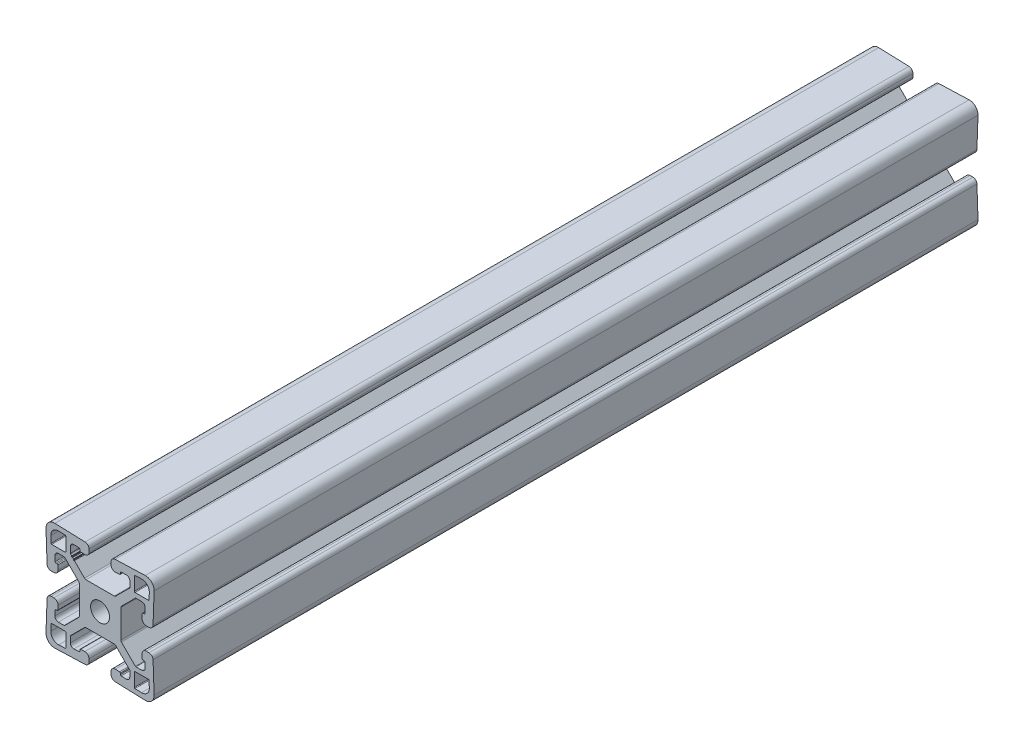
SolidWorks part; units mm, degrees
ref_plane "Front Plane" through (0, 0, 0) normal (0, 0, 1) x (1, 0, 0)
ref_plane "Top Plane" through (0, 0, 0) normal (0, 1, 0) x (1, 0, 0)
ref_plane "Right Plane" through (0, 0, 0) normal (1, 0, 0) x (0, 0, -1)
sketch "Sketch1" plane through (0, 0, 0) normal (0, 0, 1) x (1, 0, 0)
  line L0 (0, 0) -> (0, 20) construction
  line L1 (0, 0) -> (20, 0) construction
  line L2 (0, 0) -> (-20, 20) construction
  line L3 (-16.7142, 19.9981) -> (-5.5358, 19.6077)
  line L4 (-20, 20) -> (0, 20) construction
  line L5 (-4.064, 18.0836) -> (-4.064, 17.069)
  line L6 (-5.6422, 15.5449) -> (-7.1936, 15.5991)
  line L7 (-7.5, 15.9164) -> (-7.5, 16.3198)
  line L8 (-7.8064, 16.6371) -> (-9.6857, 16.7028)
  line L9 (-11, 15.4335) -> (-11, 13.2868)
  line L10 (0, 7.681) -> (-5.2101, 7.681)
  line L11 (-5.7489, 7.9042) -> (-10.907, 13.0623)
  line L12 (-7.9042, 5.7489) -> (-13.0623, 10.907)
  line L13 (-7.681, 0) -> (-7.681, 5.2101)
  line L14 (-15.4335, 11) -> (-13.2868, 11)
  line L15 (-16.6371, 7.8064) -> (-16.7028, 9.6857)
  line L16 (-15.9164, 7.5) -> (-16.3198, 7.5)
  line L17 (-15.5449, 5.6422) -> (-15.5991, 7.1936)
  line L18 (-18.0836, 4.064) -> (-17.069, 4.064)
  line L19 (-19.9981, 16.7142) -> (-19.6077, 5.5358)
  line L20 (-18.2207, 15.3309) -> (-18.1275, 12.661)
  line L21 (-15.3309, 18.2207) -> (-12.661, 18.1275)
  line L22 (-18.1275, 12.661) -> (-12.661, 12.661)
  line L23 (-12.661, 18.1275) -> (-12.661, 12.661)
  line L24 (0, 0) -> (-20, 0) construction
  line L25 (-20, 0) -> (0, 0) construction
  line L26 (0, 0) -> (0, -20) construction
  line L27 (-20, -20) -> (-20, 20) construction
  line L28 (0, 20) -> (20, 20) construction
  line L30 (-20, -20) -> (20, -20) construction
  arc A0 (-19.9981, 16.7142) -> (-16.7142, 19.9981) centre (-16.825, 16.825) cw
  arc A1 (-7.1936, 15.5991) -> (-7.5, 15.9164) centre (-7.1825, 15.9164) cw
  arc A2 (-7.5, 16.3198) -> (-7.8064, 16.6371) centre (-7.8175, 16.3198) ccw
  arc A3 (-9.6857, 16.7028) -> (-11, 15.4335) centre (-9.73, 15.4335) ccw
  arc A4 (-4.064, 17.069) -> (-5.6422, 15.5449) centre (-5.589, 17.069) cw
  arc A5 (-5.5358, 19.6077) -> (-4.064, 18.0836) centre (-5.589, 18.0836) cw
  arc A6 (-5.2101, 7.681) -> (-5.7489, 7.9042) centre (-5.2101, 8.443) cw
  arc A7 (-7.9042, 5.7489) -> (-7.681, 5.2101) centre (-8.443, 5.2101) cw
  arc A8 (-11, 13.2868) -> (-10.907, 13.0623) centre (-10.6825, 13.2868) ccw
  arc A9 (-18.0836, 4.064) -> (-19.6077, 5.5358) centre (-18.0836, 5.589) cw
  arc A10 (-15.5449, 5.6422) -> (-17.069, 4.064) centre (-17.069, 5.589) cw
  arc A11 (-15.9164, 7.5) -> (-15.5991, 7.1936) centre (-15.9164, 7.1825) cw
  arc A12 (-16.6371, 7.8064) -> (-16.3198, 7.5) centre (-16.3198, 7.8175) ccw
  arc A13 (-15.4335, 11) -> (-16.7028, 9.6857) centre (-15.4335, 9.73) ccw
  arc A14 (-13.0623, 10.907) -> (-13.2868, 11) centre (-13.2868, 10.6825) ccw
  arc A15 (-15.3309, 18.2207) -> (-18.2207, 15.3309) centre (-15.4284, 15.4284) ccw
  circle A16 centre (0, 0) radius 3.5
  point P26 (-7.5, 15.6098)
  point P29 (-7.5, 16.6264)
  point P32 (-11, 16.7487)
  point P35 (-4.064, 15.4898)
  point P38 (-4.064, 19.5563)
  point P42 (-5.5257, 7.681)
  point P45 (-7.681, 5.5257)
  point P48 (-11, 13.1553)
  point P51 (-19.5563, 4.064)
  point P54 (-15.4898, 4.064)
  point P57 (-15.6098, 7.5)
  point P60 (-16.6264, 7.5)
  point P63 (-16.7487, 11)
  point P66 (-13.1553, 11)
  point P80 (-20, 0)
  point P85 (0, -20)
  point P88 (0, -20)
sketch "Sketch2" plane through (0, 0, 0) normal (1, 0, 0) x (0, 0, -1)
  line L0 (-152.4, 0) -> (152.4, 0)
  line L1 (-152.4, -20) -> (-152.4, 20) construction
  line L2 (0, 0) -> (0, 20) construction
  line L3 (0, 0) -> (0, 20) construction
  line L4 (152.4, -20) -> (152.4, 20) construction
  point P0 (-92.4, 0)
  point P3 (0, 0)
  point P7 (92.4, 0)
  point P11 (-152.4, 0)
  point P14 (152.4, 0)
sketch "Sketch3" plane through (0, 0, 0) normal (0, 0, 1) x (1, 0, 0)
  line L0 (-7.681, 0) -> (-7.681, 5.2101) construction
  line L1 (-7.9042, 5.7489) -> (-13.0623, 10.907) construction
  line L2 (-15.4335, 11) -> (-13.2868, 11) construction
  line L3 (-16.6371, 7.8064) -> (-16.7028, 9.6857) construction
  line L4 (-18.2207, 15.3309) -> (-18.1275, 12.661)
  line L5 (-18.1275, 12.661) -> (-12.661, 12.661)
  line L6 (-12.661, 12.661) -> (-12.661, 18.1275)
  line L7 (-12.661, 18.1275) -> (-15.3309, 18.2207)
  line L8 (-18.2207, 15.3309) -> (-18.136, 12.9061)
  line L9 (-17.8822, 12.661) -> (-12.915, 12.661)
  line L10 (-12.661, 12.915) -> (-12.661, 17.8822)
  line L11 (-12.9061, 18.136) -> (-15.3309, 18.2207)
  line L12 (-15.9164, 7.5) -> (-16.3198, 7.5) construction
  line L13 (-15.5449, 5.6422) -> (-15.5991, 7.1936) construction
  line L14 (-18.0836, 4.064) -> (-17.069, 4.064) construction
  line L15 (-19.9981, 16.7142) -> (-19.6077, 5.5358) construction
  line L16 (-16.7142, 19.9981) -> (-5.5358, 19.6077) construction
  line L17 (-4.064, 18.0836) -> (-4.064, 17.069) construction
  line L18 (-5.6422, 15.5449) -> (-7.1936, 15.5991) construction
  line L19 (-7.5, 15.9164) -> (-7.5, 16.3198) construction
  line L20 (-7.8064, 16.6371) -> (-9.6857, 16.7028) construction
  line L21 (-11, 15.4335) -> (-11, 13.2868) construction
  line L22 (-5.7489, 7.9042) -> (-10.907, 13.0623) construction
  line L23 (0, 7.681) -> (-5.2101, 7.681) construction
  line L24 (-7.681, 0) -> (-7.681, 5.2101)
  line L25 (-7.9042, 5.7489) -> (-13.0623, 10.907)
  line L26 (-15.4335, 11) -> (-13.2868, 11)
  line L27 (-16.6371, 7.8064) -> (-16.7028, 9.6857)
  line L28 (-15.9164, 7.5) -> (-16.3198, 7.5)
  line L29 (-15.5449, 5.6422) -> (-15.5991, 7.1936)
  line L30 (-18.0836, 4.064) -> (-17.069, 4.064)
  line L31 (-19.9981, 16.7142) -> (-19.6077, 5.5358)
  line L32 (-16.7142, 19.9981) -> (-5.5358, 19.6077)
  line L33 (-4.064, 18.0836) -> (-4.064, 17.069)
  line L34 (-5.6422, 15.5449) -> (-7.1936, 15.5991)
  line L35 (-7.5, 15.9164) -> (-7.5, 16.3198)
  line L36 (-7.8064, 16.6371) -> (-9.6857, 16.7028)
  line L37 (-11, 15.4335) -> (-11, 13.2868)
  line L38 (-5.7489, 7.9042) -> (-10.907, 13.0623)
  line L39 (0, 7.681) -> (-5.2101, 7.681)
  line L40 (-7.681, 0) -> (-3.5, 0)
  line L41 (0, 3.5) -> (0, 7.681)
  arc A0 (-7.681, 5.2101) -> (-7.9042, 5.7489) centre (-8.443, 5.2101) ccw construction
  circle A1 centre (0, 0) radius 3.5
  arc A2 (0, 3.5) -> (-3.5, 0) centre (0, 0) ccw
  arc A3 (-15.3309, 18.2207) -> (-18.2207, 15.3309) centre (-15.4284, 15.4284) ccw
  arc A4 (-15.3309, 18.2207) -> (-18.2207, 15.3309) centre (-15.4284, 15.4284) ccw
  arc A5 (-13.0623, 10.907) -> (-13.2868, 11) centre (-13.2868, 10.6825) ccw construction
  arc A6 (-15.4335, 11) -> (-16.7028, 9.6857) centre (-15.4335, 9.73) ccw construction
  arc A7 (-16.6371, 7.8064) -> (-16.3198, 7.5) centre (-16.3198, 7.8175) ccw construction
  arc A8 (-15.5991, 7.1936) -> (-15.9164, 7.5) centre (-15.9164, 7.1825) ccw construction
  arc A9 (-17.069, 4.064) -> (-15.5449, 5.6422) centre (-17.069, 5.589) ccw construction
  arc A10 (-19.6077, 5.5358) -> (-18.0836, 4.064) centre (-18.0836, 5.589) ccw construction
  arc A11 (-16.7142, 19.9981) -> (-19.9981, 16.7142) centre (-16.825, 16.825) ccw construction
  arc A12 (-4.064, 18.0836) -> (-5.5358, 19.6077) centre (-5.589, 18.0836) ccw construction
  arc A13 (-5.6422, 15.5449) -> (-4.064, 17.069) centre (-5.589, 17.069) ccw construction
  arc A14 (-7.5, 15.9164) -> (-7.1936, 15.5991) centre (-7.1825, 15.9164) ccw construction
  arc A15 (-7.5, 16.3198) -> (-7.8064, 16.6371) centre (-7.8175, 16.3198) ccw construction
  arc A16 (-9.6857, 16.7028) -> (-11, 15.4335) centre (-9.73, 15.4335) ccw construction
  arc A17 (-11, 13.2868) -> (-10.907, 13.0623) centre (-10.6825, 13.2868) ccw construction
  arc A18 (-5.7489, 7.9042) -> (-5.2101, 7.681) centre (-5.2101, 8.443) ccw construction
  arc A19 (-7.681, 5.2101) -> (-7.9042, 5.7489) centre (-8.443, 5.2101) ccw
  arc A20 (-13.0623, 10.907) -> (-13.2868, 11) centre (-13.2868, 10.6825) ccw
  arc A21 (-15.4335, 11) -> (-16.7028, 9.6857) centre (-15.4335, 9.73) ccw
  arc A22 (-16.6371, 7.8064) -> (-16.3198, 7.5) centre (-16.3198, 7.8175) ccw
  arc A23 (-15.5991, 7.1936) -> (-15.9164, 7.5) centre (-15.9164, 7.1825) ccw
  arc A24 (-17.069, 4.064) -> (-15.5449, 5.6422) centre (-17.069, 5.589) ccw
  arc A25 (-19.6077, 5.5358) -> (-18.0836, 4.064) centre (-18.0836, 5.589) ccw
  arc A26 (-16.7142, 19.9981) -> (-19.9981, 16.7142) centre (-16.825, 16.825) ccw
  arc A27 (-4.064, 18.0836) -> (-5.5358, 19.6077) centre (-5.589, 18.0836) ccw
  arc A28 (-5.6422, 15.5449) -> (-4.064, 17.069) centre (-5.589, 17.069) ccw
  arc A29 (-7.5, 15.9164) -> (-7.1936, 15.5991) centre (-7.1825, 15.9164) ccw
  arc A30 (-7.5, 16.3198) -> (-7.8064, 16.6371) centre (-7.8175, 16.3198) ccw
  arc A31 (-9.6857, 16.7028) -> (-11, 15.4335) centre (-9.73, 15.4335) ccw
  arc A32 (-11, 13.2868) -> (-10.907, 13.0623) centre (-10.6825, 13.2868) ccw
  arc A33 (-5.7489, 7.9042) -> (-5.2101, 7.681) centre (-5.2101, 8.443) ccw
  arc A36 (-12.661, 17.8822) -> (-12.9061, 18.136) centre (-12.915, 17.8822) ccw
  arc A37 (-12.915, 12.661) -> (-12.661, 12.915) centre (-12.915, 12.915) ccw
  arc A38 (-18.136, 12.9061) -> (-17.8822, 12.661) centre (-17.8822, 12.915) ccw
  dimension "D3" = 0.254
  dimension "D1" = 0
  dimension "D2" = 0
extrude "Boss-Extrude1" add sketch "Sketch3" along normal mid plane 304.8
pattern_circular "CirPattern1" count 4 over 360 about axis through (0, 0, 0) along (0, 0, 1) of "Boss-Extrude1"
sketch "Sketch4" plane through (0, 0, 0) normal (0, 0, 1) x (1, 0, 0)
  line L1 (-10.5057, 12.661) -> (-9.5057, 12.661)
  line L8 (-5.7489, 7.9042) -> (-10.907, 13.0623) construction
  line L9 (-9.5057, 12.661) -> (-9.5057, 11.661)
  line L10 (-9.5057, 11.661) -> (-9.8391, 11.661)
  line L12 (-10.1724, 12.3277) -> (-9.8391, 11.9943)
  line L20 (-9.8391, 11.9943) -> (-9.8391, 12.3277) construction
  line L22 (-9.8391, 11.661) -> (-9.8391, 11.9943)
  line L23 (-9.8391, 12.3277) -> (-10.1724, 12.3277) construction
  line L25 (-10.1724, 12.3277) -> (-10.5057, 12.3277)
  line L26 (-10.5057, 12.3277) -> (-10.5057, 12.661)
  line L27 (-17.8822, 12.661) -> (-12.915, 12.661) construction
  dimension "D2" = 1
extrude "Cut-Extrude1" cut sketch "Sketch4" against normal through all both and the other way through all
ref_plane "Contact Plane 1" through (0, 20, 0) normal (0, 1, 0) x (1, 0, 0)
ref_plane "Contact Plane 2" through (20, 0, 0) normal (1, 0, 0) x (0, 0, -1)
ref_plane "Contact Plane 3" through (0, -20, 0) normal (0, -1, 0) x (-1, 0, 0)
ref_plane "Contact Plane 4" through (-20, 0, 0) normal (-1, 0, 0) x (0, 0, 1)
equation "\"D1@Sketch2\"=\"Rail Width@Sketch1\"*1.5"
equation "\"D1@Boss-Extrude1\"=\"Length@Sketch2\""
equation "\"ShaftDiameter\"= 12mm"
equation "\"PendulumDiameter\"=12mm"
equation "\"PendulumLength\"= 140mm"
equation "\"EncoderOuterDiameter\"=1.5"
equation "\"EncoderShaftDiameter\"= 6mm"
equation "\"EncoderShaftLength\"=15mm+.5in+3mm"
equation "\"PendulumHolderangle\"=60"
equation "\"PendulumholderBottomHeight\"= 75"
equation "\"PendulumholderBottomWidth\"= 75"
equation "\"PendulumholderHeight\"=25"
equation "\"BearingOutsideDiameter\"=21mm"
equation "\"PendulumHolderWidth\"= 100mm"
equation "\"ShaftHeightFromTSlot\"= 100mm"
equation "\"BearingThickness\"= 5mm"
equation "\"SlipRingOuterDiameter\"=56mm"
equation "\"SlipringBigThickness\"=25mm"
equation "\"SlipringSmallThickness\"=8.5mm"
equation "\"Tol\"=2mm"
equation "\"ScrewHole\"= 5mm"
equation "\"Tframwidth\"= 40mm"
equation "\"TFrameheight\"= 12in"
equation "\"Length@Sketch2\"=\"TFrameheight\""
